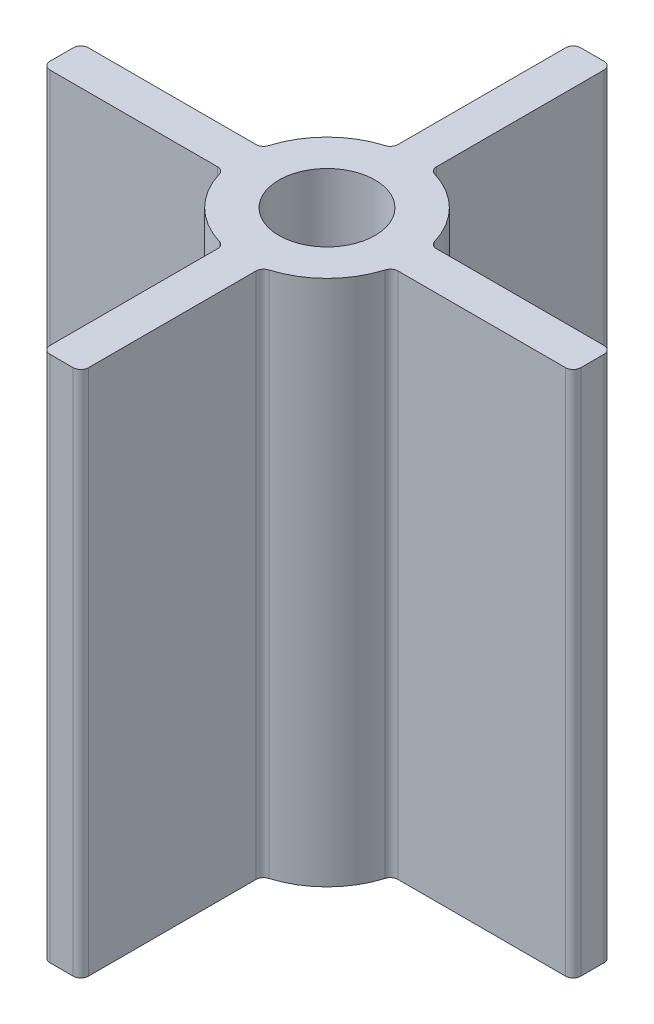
SolidWorks part; units mm, degrees
ref_plane "Front Plane" through (0, 0, 0) normal (0, 0, 1) x (1, 0, 0)
ref_plane "Top Plane" through (0, 0, 0) normal (0, 1, 0) x (1, 0, 0)
ref_plane "Right Plane" through (0, 0, 0) normal (1, 0, 0) x (0, 0, -1)
sketch "Sketch1" plane through (0, 0, 0) normal (0, 1, 0) x (1, 0, 0)
  circle A0 centre (0, 0) radius 6.25
  circle A1 centre (0, 0) radius 11.25
  point P4 (0, 11.25)
  point P5 (0, -11.25)
  point P6 (11.25, 0)
  point P7 (-11.25, 0)
  dimension "D1" = 12.5
  dimension "D2" = 5
extrude "Boss-Extrude1" add sketch "Sketch1" along normal mid plane 68.5
ref_plane "Plane1" through (0, -34.25, 0) normal (0, -1, 0) x (-1, 0, 0)
sketch "Sketch2" plane through (0, -34.25, 0) normal (0, -1, 0) x (-1, 0, 0)
  line L0 (2.5, -10.25) -> (-2.5, -10.25)
  line L1 (-2.5, -10.25) -> (-2.5, -34.5)
  line L2 (2.5, -10.25) -> (2.5, -34.5)
  line L3 (0, 0) -> (0, -34.5) construction
  line L4 (0, 0) -> (0, 34.5) construction
  line L5 (-2.5, -34.5) -> (2.5, -34.5)
  line L6 (-34.5, 2.5) -> (-34.5, -2.5)
  line L7 (-10.25, -2.5) -> (-34.5, -2.5)
  line L8 (-10.25, 2.5) -> (-34.5, 2.5)
  line L9 (-10.25, -2.5) -> (-10.25, 2.5)
  line L10 (2.5, 34.5) -> (-2.5, 34.5)
  line L11 (-2.5, 10.25) -> (-2.5, 34.5)
  line L12 (2.5, 10.25) -> (2.5, 34.5)
  line L13 (-2.5, 10.25) -> (2.5, 10.25)
  line L14 (34.5, -2.5) -> (34.5, 2.5)
  line L15 (10.25, 2.5) -> (34.5, 2.5)
  line L16 (10.25, -2.5) -> (34.5, -2.5)
  line L17 (10.25, 2.5) -> (10.25, -2.5)
  circle A0 centre (0, 0) radius 11.25 construction
  point P0 (0, -11.25)
  point P1 (0, 11.25)
  point P4 (-11.25, 0)
  point P5 (11.25, 0)
  point P14 (0, -10.25)
  point P20 (-10.25, 0)
  point P25 (0, 10.25)
  point P30 (10.25, 0)
  point P33 (0, 0)
  dimension "D1" = 34.5
  dimension "D2" = 34.5
  dimension "D3" = 5
  dimension "D4" = 1
  dimension "D5" = 5
  dimension "D6" = 4
extrude "Boss-Extrude2" add sketch "Sketch2" against normal blind 68.5
fillet "Fillet1" radius 1 1 edges at (-2.5, 0, 10.9687)
fillet "Fillet2" radius 1 7 edges at (10.9687, 0, 2.5) (2.5, 0, 10.9687) (2.5, 0, -10.9687) (10.9687, 0, -2.5) (-2.5, 0, -10.9687) (-10.9687, 0, -2.5) (-10.9687, 0, 2.5)
fillet "Fillet3" radius 1 1 edges at (-2.5, 0, 34.5)
fillet "Fillet4" radius 1 1 edges at (2.5, 0, 34.5)
fillet "Fillet5" radius 1 6 edges at (34.5, 0, -2.5) (34.5, 0, 2.5) (2.5, 0, -34.5) (-2.5, 0, -34.5) (-34.5, 0, -2.5) (-34.5, 0, 2.5)
